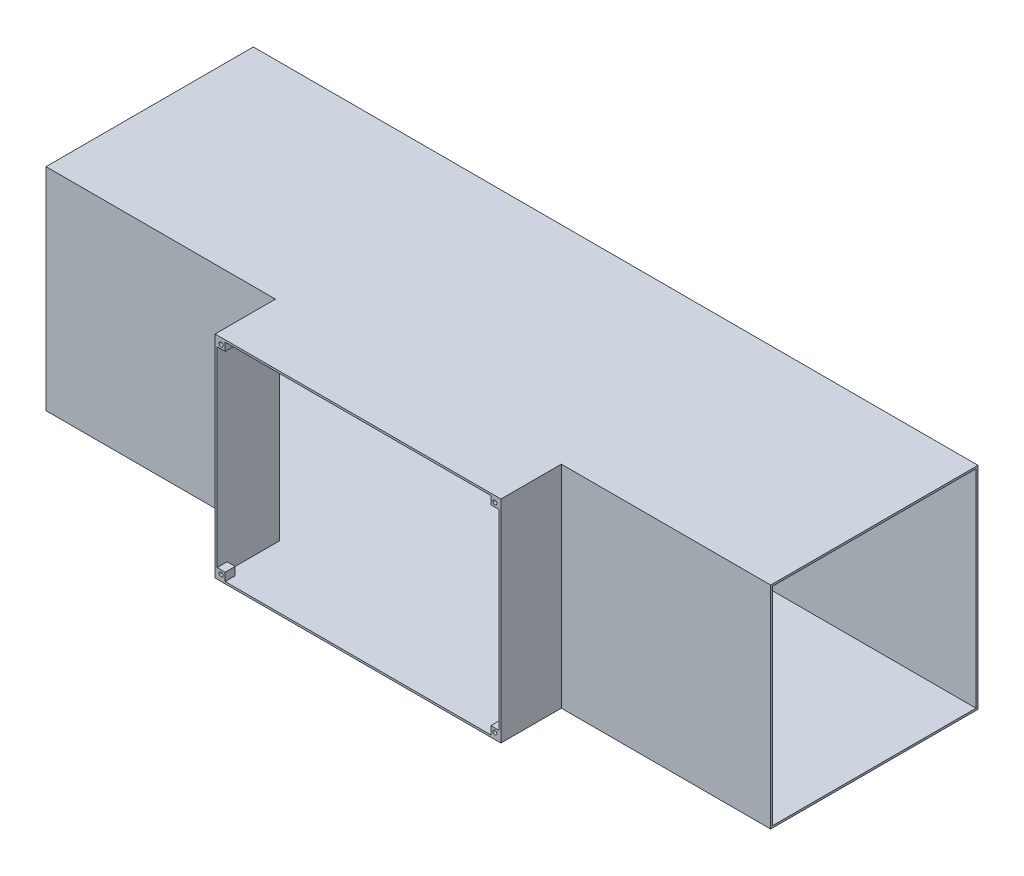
SolidWorks part; units mm, degrees
ref_plane "Front Plane" through (0, 0, 0) normal (0, 0, 1) x (1, 0, 0)
ref_plane "Top Plane" through (0, 0, 0) normal (0, 1, 0) x (1, 0, 0)
ref_plane "Right Plane" through (0, 0, 0) normal (1, 0, 0) x (0, 0, -1)
sketch "Sketch1" plane through (0, 0, 0) normal (1, 0, 0) x (0, 0, -1)
  line L0 (-118.8156, -93.1483) -> (-118.8156, 173.5517)
  line L1 (140.2644, -90.6083) -> (-116.2756, -90.6083)
  line L2 (140.2644, -90.6083) -> (140.2644, 171.0117)
  line L3 (140.2644, 171.0117) -> (-116.2756, 171.0117)
  line L4 (-116.2756, -90.6083) -> (-116.2756, 171.0117)
  line L5 (142.8044, 173.5517) -> (-118.8156, 173.5517)
  line L6 (142.8044, -93.1483) -> (142.8044, 173.5517)
  line L7 (142.8044, -93.1483) -> (-118.8156, -93.1483)
  dimension "D1" = 261.62
  dimension "D2" = 256.54
  dimension "D3" = 2.54
extrude "Boss-Extrude1" add sketch "Sketch1" along normal blind 914.4
sketch "Sketch2" plane through (0, 0, 118.8156) normal (0, 0, 1) x (1, 0, 0)
  line L0 (914.4, -93.1483) -> (0, -93.1483) construction
  line L1 (292.1, 171.0117) -> (647.7, 171.0117)
  line L2 (292.1, 171.0117) -> (292.1, -90.6083)
  line L3 (292.1, -90.6083) -> (647.7, -90.6083)
  line L4 (647.7, 171.0117) -> (647.7, -90.6083)
  line L5 (0, 173.5517) -> (0, -93.1483) construction
  dimension "D1" = 261.62
  dimension "D2" = 2.54
  dimension "14" = 355.6
  dimension "D4" = 292.1
extrude "Cut-Extrude1" cut sketch "Sketch2" against normal blind 25.4
sketch "Sketch3" plane through (0, 0, 118.8156) normal (0, 0, 1) x (1, 0, 0)
  line L0 (289.56, -93.1483) -> (289.56, 173.5517)
  line L1 (292.1, -90.6083) -> (647.7, -90.6083)
  line L2 (292.1, -90.6083) -> (292.1, 171.0117)
  line L3 (292.1, 171.0117) -> (647.7, 171.0117)
  line L4 (647.7, -90.6083) -> (647.7, 171.0117)
  line L5 (289.56, 173.5517) -> (650.24, 173.5517)
  line L6 (650.24, -93.1483) -> (650.24, 173.5517)
  line L7 (289.56, -93.1483) -> (650.24, -93.1483)
  dimension "D1" = 2.54
extrude "Boss-Extrude2" add sketch "Sketch3" along normal blind 76.2
sketch "Sketch4" plane through (0, 0, 195.0156) normal (0, 0, 1) x (1, 0, 0)
  line L1 (289.56, -93.1483) -> (650.24, -93.1483)
  line L2 (289.56, -93.1483) -> (289.56, 173.5517)
  line L3 (289.56, 173.5517) -> (650.24, 173.5517)
  line L4 (650.24, -93.1483) -> (650.24, 173.5517)
sketch "Sketch6" plane through (0, 0, 195.0156) normal (0, 0, 1) x (1, 0, 0)
  line L1 (292.1, 171.0117) -> (302.26, 171.0117)
  line L2 (292.1, 171.0117) -> (292.1, 160.8517)
  line L3 (292.1, 160.8517) -> (302.26, 160.8517)
  line L4 (302.26, 171.0117) -> (302.26, 160.8517)
  line L8 (292.1, -80.4483) -> (292.1, -90.6083)
  line L9 (292.1, -80.4483) -> (302.26, -80.4483)
  line L10 (302.26, -80.4483) -> (302.26, -90.6083)
  line L11 (292.1, -90.6083) -> (302.26, -90.6083)
  line L24 (637.54, 171.0117) -> (647.7, 171.0117)
  line L25 (637.54, 171.0117) -> (637.54, 160.8517)
  line L26 (637.54, 160.8517) -> (647.7, 160.8517)
  line L27 (647.7, 171.0117) -> (647.7, 160.8517)
  line L28 (637.54, -80.4483) -> (637.54, -90.6083)
  line L29 (637.54, -80.4483) -> (647.7, -80.4483)
  line L30 (647.7, -80.4483) -> (647.7, -90.6083)
  line L31 (637.54, -90.6083) -> (647.7, -90.6083)
  circle A0 centre (297.18, 165.9317) radius 2.54
  circle A2 centre (297.18, -85.5283) radius 2.54
  circle A6 centre (642.62, 165.9317) radius 2.54
  circle A7 centre (642.62, -85.5283) radius 2.54
  dimension "D3" = 5.08
  dimension "D4" = 5.08
  dimension "D5" = 5.08
  dimension "D1" = 10.16
  dimension "D2" = 10.16
  dimension "D7" = 2
  dimension "D6" = 2
extrude "Boss-Extrude5" add sketch "Sketch6" against normal blind 12.7
